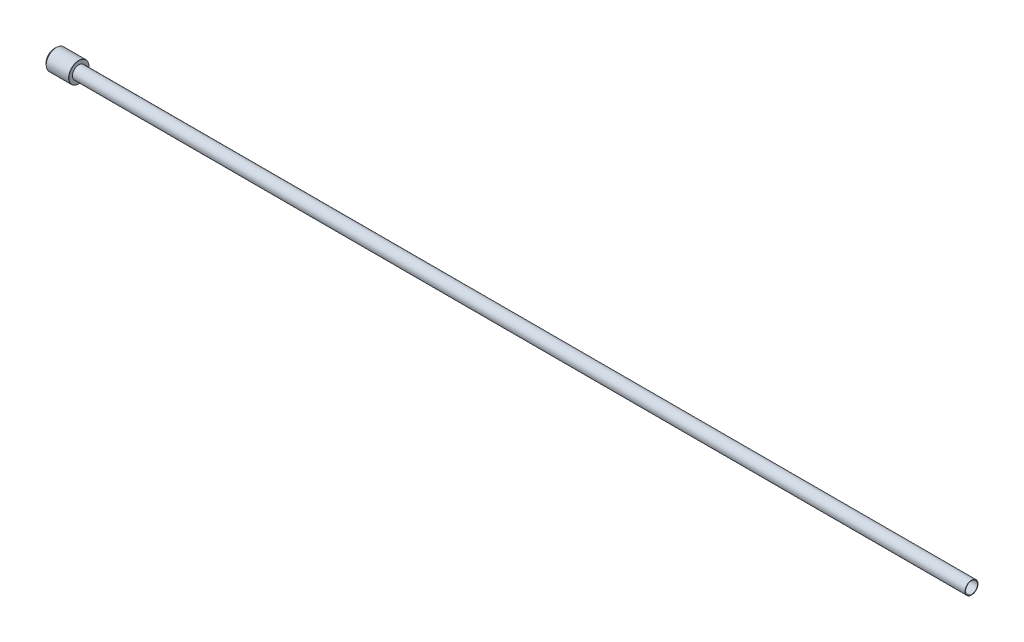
SolidWorks part; units mm, degrees
ref_plane "Front Plane" through (0, 0, 0) normal (0, 0, 1) x (1, 0, 0)
ref_plane "Top Plane" through (0, 0, 0) normal (0, 1, 0) x (1, 0, 0)
ref_plane "Right Plane" through (0, 0, 0) normal (1, 0, 0) x (0, 0, -1)
sketch "Sketch1" plane through (0, 0, 0) normal (0, 0, 1) x (1, 0, 0)
  line L0 (0.945, 5) -> (10, 5)
  line L1 (12, 3.175) -> (450, 3.175)
  line L2 (10, 5) -> (12, 5)
  line L4 (12, 5) -> (12, 3.175)
  line L5 (450, 3.175) -> (450, 2.921)
  line L7 (450, 2.921) -> (0, 2.921)
  line L8 (0, 2.921) -> (0, 4.155)
  line L9 (-22.2122, 0) -> (63.2184, 0) construction
  line L10 (0, 4.155) -> (0.1, 4.155)
  line L12 (0.1, 4.155) -> (0.945, 5)
  dimension "D2" = 10
  dimension "Thread" = 10
  dimension "D3" = 12
  dimension "tube ID" = 5.842
  dimension "D4" = 450
  dimension "D5" = 6.35
  dimension "minor diameter" = 8.31
  dimension "D9" = 45
  dimension "D10" = 0.1
revolve "Revolve1" add sketch "Sketch1" angle 360 about L9
fillet "Fillet2" radius 0.1 1 edges at (12, 0, 5)
